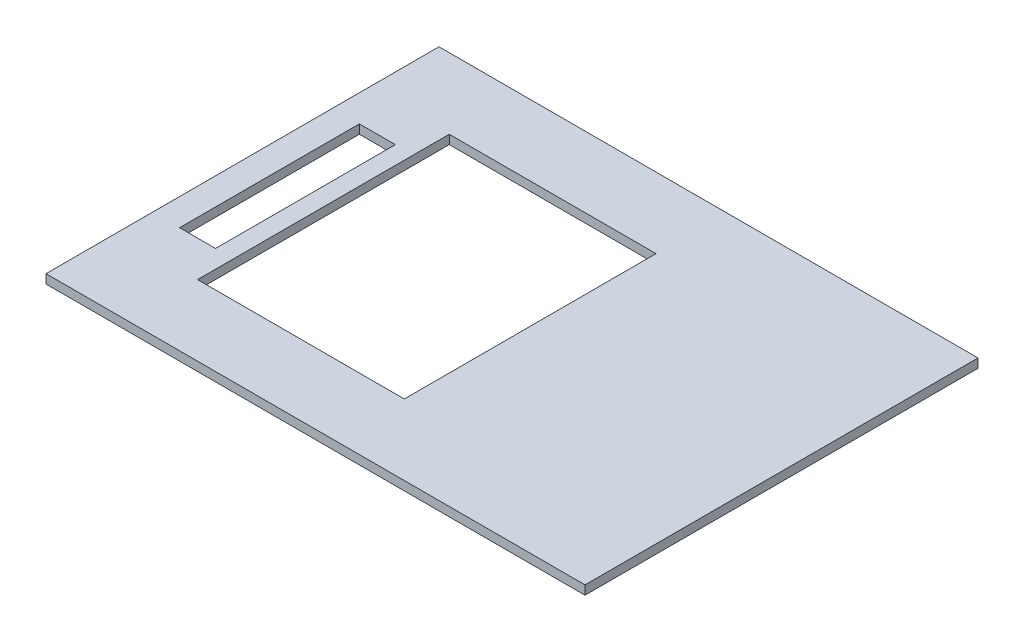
SolidWorks part; units mm, degrees
ref_plane "Front Plane" through (0, 0, 0) normal (0, 0, 1) x (1, 0, 0)
ref_plane "Top Plane" through (0, 0, 0) normal (0, 1, 0) x (1, 0, 0)
ref_plane "Right Plane" through (0, 0, 0) normal (1, 0, 0) x (0, 0, -1)
sketch "Sketch1" plane through (0, 0, 0) normal (0, 1, 0) x (1, 0, 0)
  line L1 (-149.9, -109.3) -> (149.9, -109.3)
  line L2 (-149.9, -109.3) -> (-149.9, 109.3)
  line L3 (-149.9, 109.3) -> (149.9, 109.3)
  line L4 (149.9, -109.3) -> (149.9, 109.3)
  line L5 (-149.9, -109.3) -> (149.9, 109.3) construction
  line L6 (-149.9, 109.3) -> (149.9, -109.3) construction
  point P0 (0, 0)
  dimension "D1" = 299.8
  dimension "D2" = 218.6
extrude "Boss-Extrude1" add sketch "Sketch1" along normal blind 5
sketch "Sketch2" plane through (0, 5, 0) normal (0, 1, 0) x (1, 0, 0)
  line L0 (-149.9, 109.3) -> (-149.9, -109.3) construction
  line L1 (-134.9, -50) -> (-114.9, -50)
  line L2 (-134.9, -50) -> (-134.9, 50)
  line L3 (-134.9, 50) -> (-114.9, 50)
  line L4 (-114.9, -50) -> (-114.9, 50)
  line L5 (-134.9, -50) -> (-114.9, 50) construction
  line L6 (-134.9, 50) -> (-114.9, -50) construction
  point P0 (-124.9, 0)
  dimension "D1" = 20
  dimension "D2" = 100
  dimension "D3" = 25
extrude "Cut-Extrude1" cut sketch "Sketch2" against normal blind 5
sketch "Sketch3" plane through (0, 5, 0) normal (0, 1, 0) x (1, 0, 0)
  line L0 (-114.9, -50) -> (-114.9, 50) construction
  line L1 (-104.9, 70) -> (10.1, 70)
  line L2 (-104.9, 70) -> (-104.9, -70)
  line L3 (-104.9, -70) -> (10.1, -70)
  line L4 (10.1, 70) -> (10.1, -70)
  line L5 (-104.9, 70) -> (10.1, -70) construction
  line L6 (-104.9, -70) -> (10.1, 70) construction
  point P4 (-47.4, 0)
  dimension "D1" = 140
  dimension "D2" = 115
  dimension "D3" = 10
extrude "Cut-Extrude2" cut sketch "Sketch3" against normal blind 10
